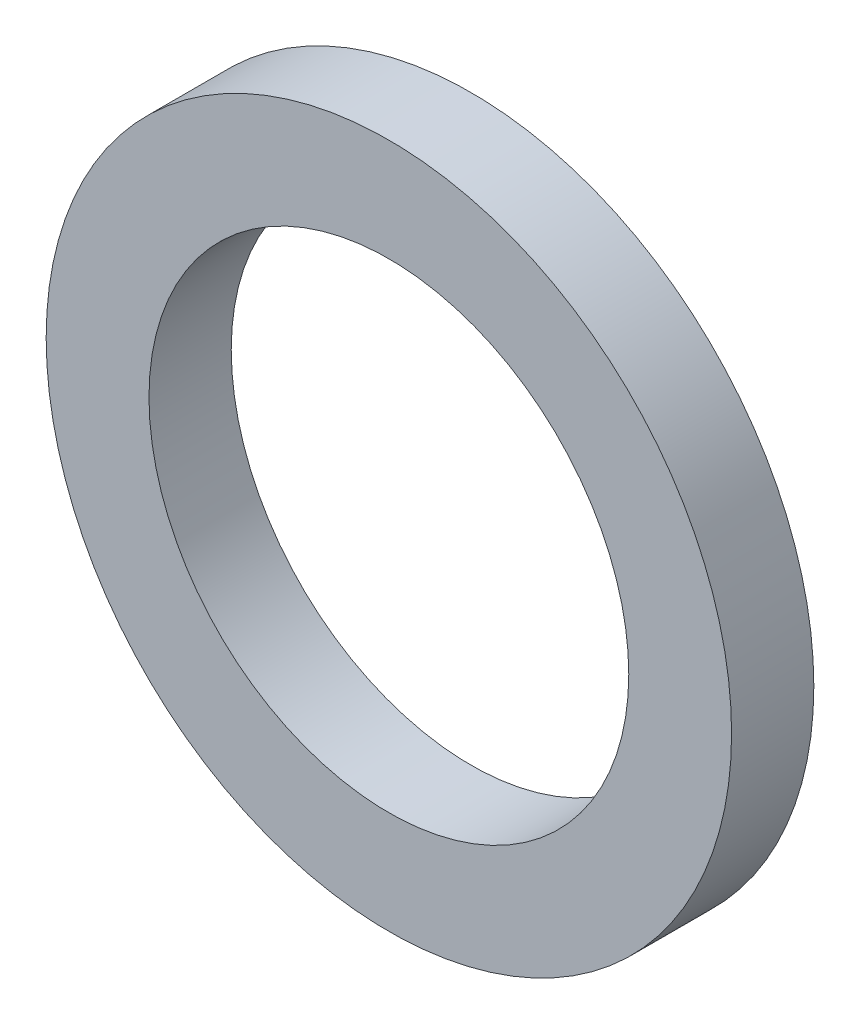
SolidWorks part; units mm, degrees
ref_plane "Plan de face" through (0, 0, 0) normal (0, 0, 1) x (1, 0, 0)
ref_plane "Plan de dessus" through (0, 0, 0) normal (0, 1, 0) x (1, 0, 0)
ref_plane "Plan de droite" through (0, 0, 0) normal (1, 0, 0) x (0, 0, -1)
sketch "Esquisse1" plane through (0, 0, 0) normal (0, 0, 1) x (1, 0, 0)
  circle A0 centre (0, 0) radius 3.5
  circle A1 centre (0, 0) radius 5
  dimension "D1" = 10
  dimension "D2" = 7
extrude "Boss.-Extru.1" add sketch "Esquisse1" along normal blind 1.2
